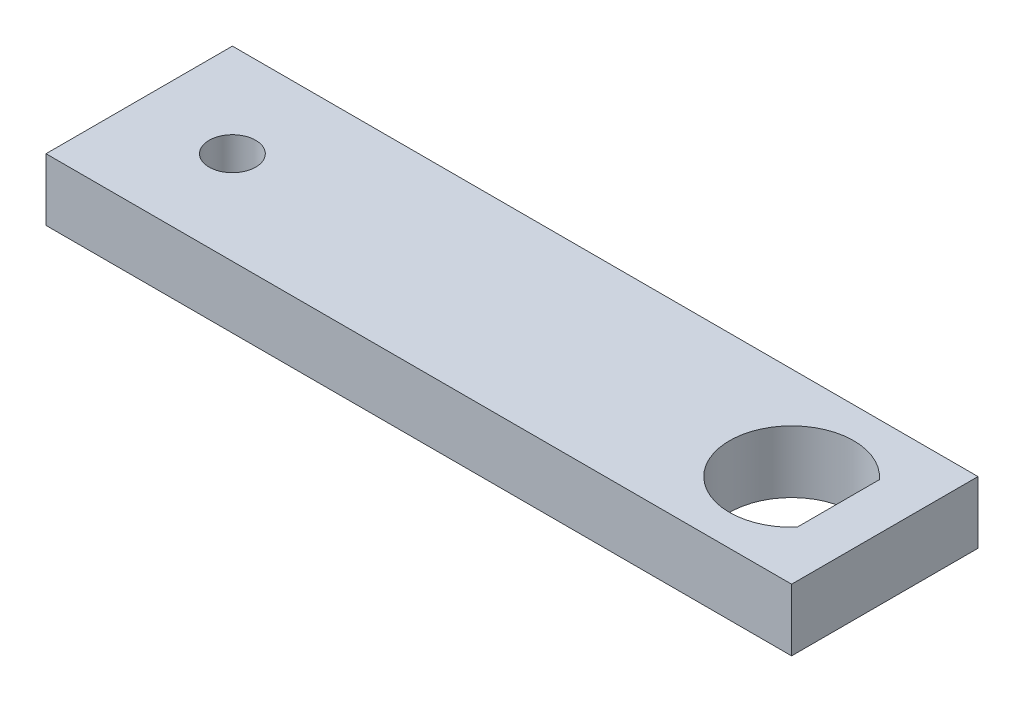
SolidWorks part; units mm, degrees
extrude "Base-Extrude" add sketch "Sketch1" along normal blind 19.05
sketch "Sketch1" plane through (0, 0, 0) normal (0, 0, 1) x (1, 0, 0)
  line L0 (0, 0) -> (76.2, 0)
  line L1 (0, 0) -> (0, 6.35)
  line L2 (76.2, 6.35) -> (0, 6.35)
  line L3 (76.2, 6.35) -> (76.2, 0)
  dimension "D1" = 6.35
  dimension "D2" = 76.2
extrude "Cut-Extrude1" cut sketch "Sketch2" against normal through all
sketch "Sketch2" plane through (0, 6.35, 0) normal (0, 1, 0) x (-1, 0, 0)
  line L0 (-76.2, 19.05) -> (-76.2, 0) construction
  line L1 (-76.2, 19.05) -> (0, 19.05) construction
  line L2 (-71.4375, 5.3249) -> (-71.4375, 13.7251)
  arc A0 (-71.4375, 5.3249) -> (-71.4375, 13.7251) centre (-66.675, 9.525) ccw
  dimension "D1" = 12.7
  dimension "D2" = 9.525
  dimension "D3" = 9.525
  dimension "D4" = 1.5875
extrude "Cut-Extrude2" cut sketch "Sketch3" against normal through all
sketch "Sketch3" plane through (0, 6.35, 0) normal (0, 1, 0) x (-1, 0, 0)
  line L0 (0, 19.05) -> (0, 0) construction
  circle A0 centre (-9.525, 9.525) radius 2.3813
  arc A1 (-71.4375, 5.3249) -> (-71.4375, 13.7251) centre (-66.675, 9.525) ccw construction
  point P5 (-66.675, 9.525)
  dimension "D1" = 4.7625
  dimension "D2" = 9.525
ref_plane "Front" through (0, 0, 0) normal (0, 0, 1) x (1, 0, 0)
ref_plane "Top" through (0, 0, 0) normal (0, 1, 0) x (-1, 0, 0)
ref_plane "Right" through (0, 0, 0) normal (1, 0, 0) x (0, 0, -1)
